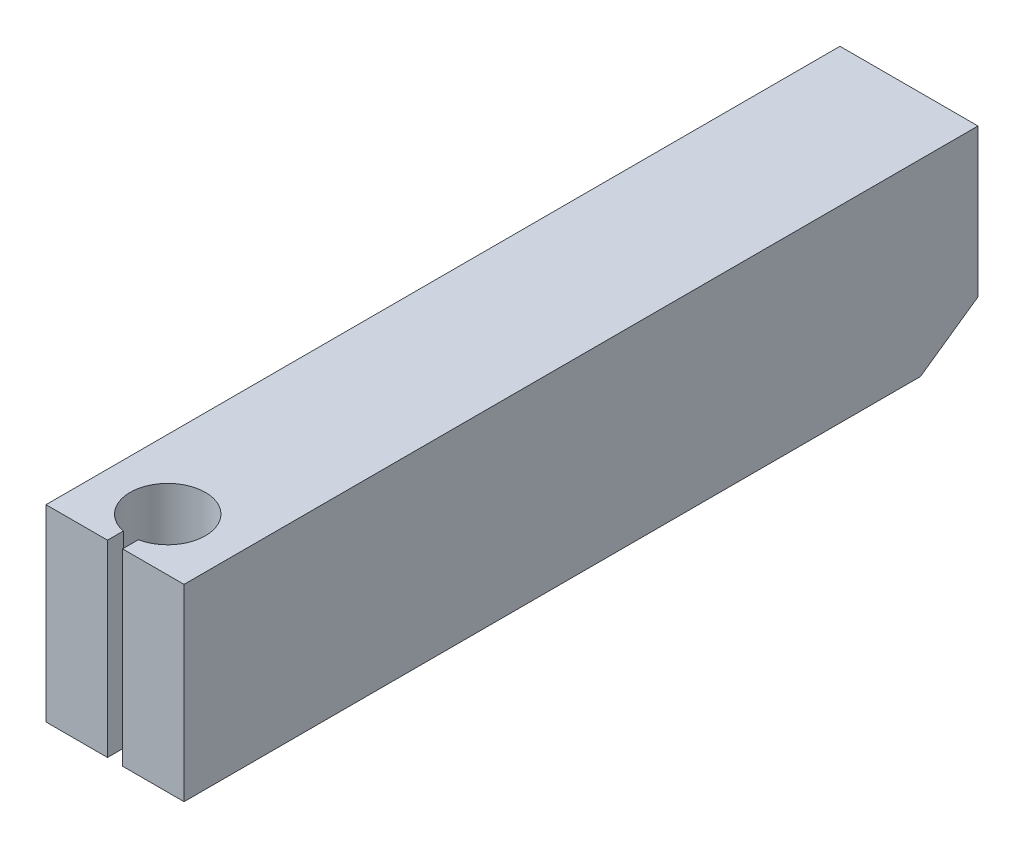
SolidWorks part; units mm, degrees
ref_plane "Face" through (0, 0, 0) normal (0, 0, 1) x (1, 0, 0)
ref_plane "Dessus" through (0, 0, 0) normal (0, 1, 0) x (1, 0, 0)
ref_plane "Droite" through (0, 0, 0) normal (1, 0, 0) x (0, 0, -1)
sketch "Esquisse1" plane through (0, 0, 0) normal (0, 0, 1) x (1, 0, 0)
  line L8 (-5.8055, 3.412) -> (-5.8055, 8.412)
  line L9 (-5.8055, 8.412) -> (-9.4721, 8.412)
  line L10 (-9.4721, 8.412) -> (-9.4721, 3.412)
  line L11 (-9.4721, 3.412) -> (-5.8055, 3.412)
  line L12 (-5.8055, 3.412) -> (-5.8055, 8.412)
  line L13 (-5.8055, 8.412) -> (-9.4721, 8.412)
  line L14 (-9.4721, 8.412) -> (-9.4721, 3.412)
  line L15 (-9.4721, 3.412) -> (-5.8055, 3.412)
  dimension "D1" = 0
extrude "Longueur" add sketch "Esquisse1" against normal up to surface (21.089 mm away)
other "Empreinte1"
other "Carter<1>@jeu blocs empreintes droit_Etudiant_Corrigé"
sketch "Esquisse2" plane through (0, 8.412, 0) normal (0, 1, 0) x (-1, 0, 0)
  line L0 (7.6388, 0) -> (7.6388, -4.0394) construction
  line L1 (5.8055, 0) -> (9.4721, 0) construction
  line L2 (9.1388, -2.4) -> (6.1388, -2.4) construction
  line L3 (7.4388, -0.4202) -> (7.4388, 0)
  line L4 (7.8388, -0.4202) -> (7.8388, 0)
  line L5 (7.4388, 0) -> (7.8388, 0)
  arc A0 (7.4388, -0.4202) -> (7.8388, -0.4202) centre (7.6388, -1.4) ccw
  dimension "D1" = 2
  dimension "D2" = 0.4
extrude "Passage goupille" cut sketch "Esquisse2" against normal through all
sketch "Esquisse3" plane through (0, 0, -21.089) normal (0, 0, -1) x (-1, 0, 0)
  line L0 (9.4721, 8.412) -> (9.4721, 3.412) construction
  line L1 (9.4721, 8.412) -> (9.4721, 3.412)
  point P2 (9.4721, 5.912)
ref_plane "Plan milieu" through (0, 5.912, 0) normal (0, 1, 0) x (-1, 0, 0)
